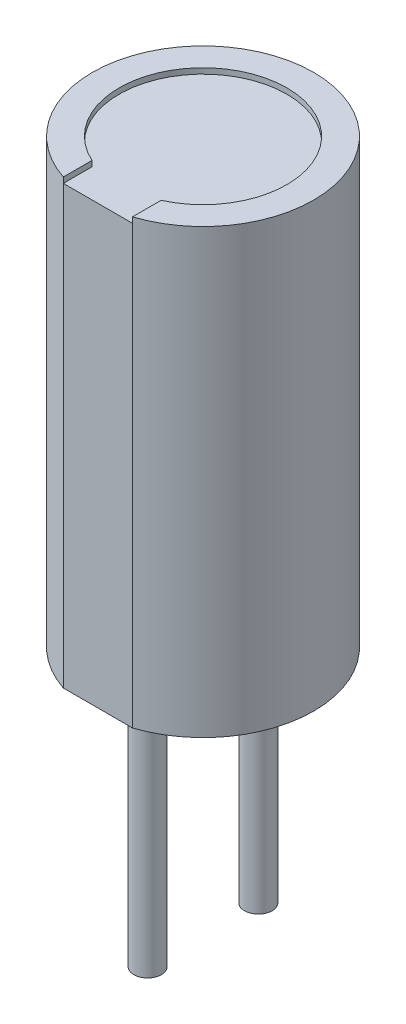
SolidWorks part; units mm, degrees
ref_plane "Plan de face" through (0, 0, 0) normal (0, 0, 1) x (1, 0, 0)
ref_plane "Plan de dessus" through (0, 0, 0) normal (0, 1, 0) x (1, 0, 0)
ref_plane "Plan de droite" through (0, 0, 0) normal (1, 0, 0) x (0, 0, -1)
sketch "Esquisse1" plane through (0, 0, 0) normal (0, 1, 0) x (1, 0, 0)
  circle A0 centre (0, 0) radius 2
  dimension "D1" = 4
extrude "Extrusion1" add sketch "Esquisse1" along normal blind 8
ref_plane "Plan1" through (0, 0, 2) normal (0, 0, 1) x (1, 0, 0)
sketch "Esquisse2" plane through (0, 0, 2) normal (0, 0, 1) x (1, 0, 0)
  line L0 (-2, 0) -> (2, 0) construction
  line L1 (-1, 0) -> (1, 0)
  line L2 (-1, 0) -> (-1, 8)
  line L3 (-1, 8) -> (1, 8)
  line L4 (1, 0) -> (1, 8)
  line L5 (2, 8) -> (-2, 8) construction
  dimension "D1" = 2
extrude "Enlèv. mat.-Extru.1" cut sketch "Esquisse2" against normal blind 0.1
sketch "Esquisse3" plane through (0, 0, 0) normal (0, -1, 0) x (1, 0, 0)
  circle A0 centre (0, 1) radius 0.25
  circle A1 centre (0, -1) radius 0.25
  dimension "D3" = 0.5
  dimension "D1" = 2
  dimension "D2" = 1
extrude "Extrusion2" add sketch "Esquisse3" along normal blind 4.5
sketch "Esquisse4" plane through (0, 8, 0) normal (0, 1, 0) x (-1, 0, 0)
  line L0 (-0.6245, 1.3814) -> (-0.6245, 1.9)
  line L1 (0.6245, 1.3814) -> (0.6245, 1.9)
  line L2 (0.6245, 1.9) -> (-0.6245, 1.9)
  arc A0 (-0.6245, 1.3814) -> (0.6245, 1.3814) centre (0, 0) ccw
extrude "Enlèv. mat.-Extru.2" cut sketch "Esquisse4" against normal blind 0.1
